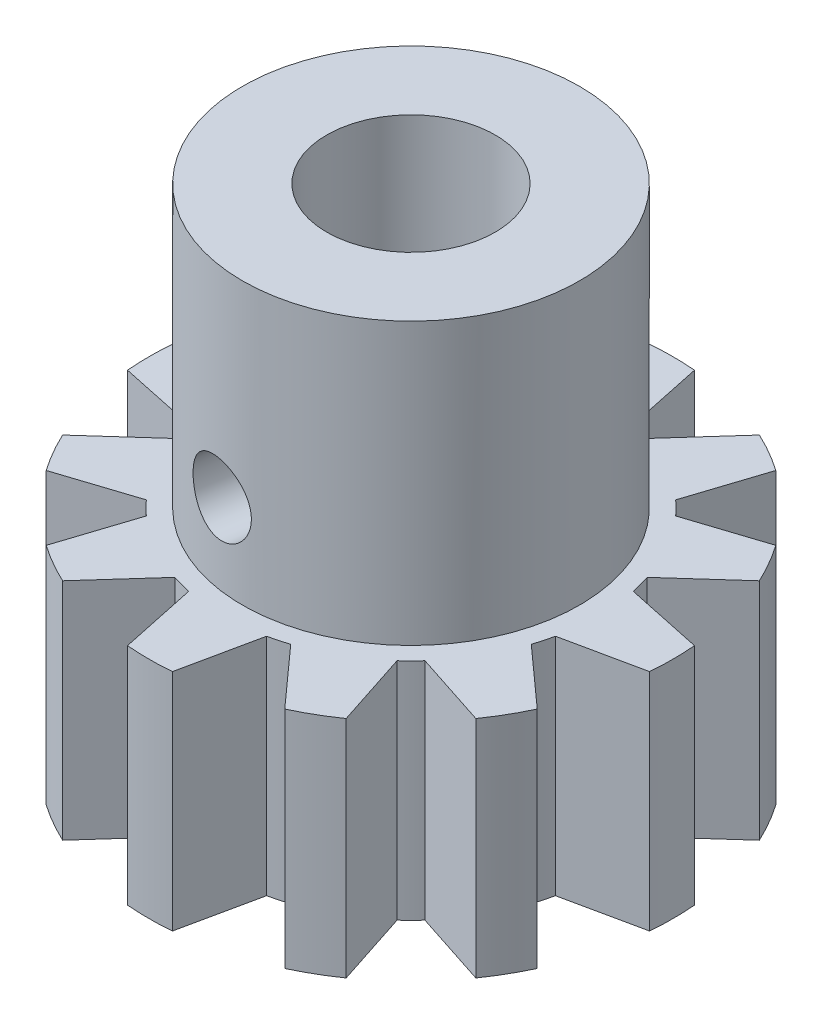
SolidWorks part; units mm, degrees
ref_plane "Front Plane" through (0, 0, 0) normal (0, 0, 1) x (1, 0, 0)
ref_plane "Top Plane" through (0, 0, 0) normal (0, 1, 0) x (1, 0, 0)
ref_plane "Right Plane" through (0, 0, 0) normal (1, 0, 0) x (0, 0, -1)
sketch "Sketch1" plane through (0, 0, 0) normal (0, 1, 0) x (1, 0, 0)
  line L0 (-0.635, 7.3768) -> (-1.0998, 5.1804)
  line L1 (0.635, 7.3768) -> (1.0998, 5.1804)
  line L2 (4.2383, 6.071) -> (3.5427, 3.9365)
  line L3 (3.1385, 6.706) -> (1.6378, 5.0363)
  line L4 (6.706, 3.1385) -> (5.0363, 1.6378)
  line L5 (6.071, 4.2383) -> (3.9365, 3.5427)
  line L6 (7.3768, -0.635) -> (5.1804, -1.0998)
  line L7 (7.3768, 0.635) -> (5.1804, 1.0998)
  line L8 (6.071, -4.2383) -> (3.9365, -3.5427)
  line L9 (6.706, -3.1385) -> (5.0363, -1.6378)
  line L10 (3.1385, -6.706) -> (1.6378, -5.0363)
  line L11 (4.2383, -6.071) -> (3.5427, -3.9365)
  line L12 (-0.635, -7.3768) -> (-1.0998, -5.1804)
  line L13 (0.635, -7.3768) -> (1.0998, -5.1804)
  line L14 (-4.2383, -6.071) -> (-3.5427, -3.9365)
  line L15 (-3.1385, -6.706) -> (-1.6378, -5.0363)
  line L16 (-6.706, -3.1385) -> (-5.0363, -1.6378)
  line L17 (-6.071, -4.2383) -> (-3.9365, -3.5427)
  line L18 (-7.3768, 0.635) -> (-5.1804, 1.0998)
  line L19 (-7.3768, -0.635) -> (-5.1804, -1.0998)
  line L20 (-6.071, 4.2383) -> (-3.9365, 3.5427)
  line L21 (-6.706, 3.1385) -> (-5.0363, 1.6378)
  line L22 (-3.1385, 6.706) -> (-1.6378, 5.0363)
  line L23 (-4.2383, 6.071) -> (-3.5427, 3.9365)
  circle A0 centre (0, 0) radius 5.2959 construction
  circle A1 centre (0, 0) radius 2.3813
  circle A2 centre (0, 0) radius 7.4041 construction
  circle A3 centre (0, 0) radius 6.35 construction
  arc A4 (-0.635, 7.3768) -> (0.635, 7.3768) centre (0, 0) cw
  arc A5 (1.0998, 5.1804) -> (1.6378, 5.0363) centre (0, 0) cw
  arc A6 (3.5427, 3.9365) -> (3.9365, 3.5427) centre (0, 0) cw
  arc A7 (3.1385, 6.706) -> (4.2383, 6.071) centre (0, 0) cw
  arc A8 (5.0363, 1.6378) -> (5.1804, 1.0998) centre (0, 0) cw
  arc A9 (6.071, 4.2383) -> (6.706, 3.1385) centre (0, 0) cw
  arc A10 (5.1804, -1.0998) -> (5.0363, -1.6378) centre (0, 0) cw
  arc A11 (7.3768, 0.635) -> (7.3768, -0.635) centre (0, 0) cw
  arc A12 (3.9365, -3.5427) -> (3.5427, -3.9365) centre (0, 0) cw
  arc A13 (6.706, -3.1385) -> (6.071, -4.2383) centre (0, 0) cw
  arc A14 (1.6378, -5.0363) -> (1.0998, -5.1804) centre (0, 0) cw
  arc A15 (4.2383, -6.071) -> (3.1385, -6.706) centre (0, 0) cw
  arc A16 (-1.0998, -5.1804) -> (-1.6378, -5.0363) centre (0, 0) cw
  arc A17 (0.635, -7.3768) -> (-0.635, -7.3768) centre (0, 0) cw
  arc A18 (-3.5427, -3.9365) -> (-3.9365, -3.5427) centre (0, 0) cw
  arc A19 (-3.1385, -6.706) -> (-4.2383, -6.071) centre (0, 0) cw
  arc A20 (-5.0363, -1.6378) -> (-5.1804, -1.0998) centre (0, 0) cw
  arc A21 (-6.071, -4.2383) -> (-6.706, -3.1385) centre (0, 0) cw
  arc A22 (-5.1804, 1.0998) -> (-5.0363, 1.6378) centre (0, 0) cw
  arc A23 (-7.3768, -0.635) -> (-7.3768, 0.635) centre (0, 0) cw
  arc A24 (-3.9365, 3.5427) -> (-3.5427, 3.9365) centre (0, 0) cw
  arc A25 (-6.706, 3.1385) -> (-6.071, 4.2383) centre (0, 0) cw
  arc A26 (-1.6378, 5.0363) -> (-1.0998, 5.1804) centre (0, 0) cw
  arc A27 (-4.2383, 6.071) -> (-3.1385, 6.706) centre (0, 0) cw
  point P6 (0, 7.4041)
  point P130 (0, 0)
  dimension "D1" = 12.7
  dimension "D2" = 14.8082
  dimension "D3" = 10.5918
  dimension "D4" = 4.7625
  dimension "D5" = 1.27
  dimension "D6" = 12
extrude "Boss-Extrude1" add sketch "Sketch1" along normal blind 6.35
sketch "Sketch2" plane through (0, 6.35, 0) normal (0, 1, 0) x (1, 0, 0)
  circle A0 centre (0, 0) radius 2.3813
  circle A1 centre (0, 0) radius 4.7625
  circle A2 centre (0, 0) radius 2.3813 construction
  dimension "D1" = 9.525
extrude "Boss-Extrude2" add sketch "Sketch2" along normal blind 7.9375
sketch "Sketch3" plane through (-15.449, 0, -3.9886) normal (-0.1578, 0, 0.9875) x (0.9875, 0, 0.1578)
  spline S1 degree 3 poles (16.0176, 9.5647) (15.7522, 9.5647) (15.6221, 9.538) (15.3824, 9.4378) (15.2734, 9.3643) (15.0926, 9.1834) (15.0192, 9.0742) (14.9197, 8.8363) (14.8929, 8.7049) (14.8925, 8.4427) (14.9187, 8.3117) (15.0193, 8.0702) (15.0923, 7.962) (15.2735, 7.7806) (15.3827, 7.7071) (15.621, 7.6074) (15.7529, 7.5805) (16.0143, 7.5801) (16.146, 7.6065) (16.3864, 7.7066) (16.4951, 7.7795) (16.6777, 7.9622) (16.7504, 8.0704) (16.8503, 8.3095) (16.8769, 8.4408) (16.8772, 8.7025) (16.8506, 8.8343) (16.751, 9.0734) (16.6781, 9.1823) (16.496, 9.3647) (16.3886, 9.4373) (16.1466, 9.5385) (16.0176, 9.5647) (15.7522, 9.5647) (15.6221, 9.538) knots -0.0625 -0.0625 0 0 0.0625 0.0625 0.125 0.125 0.1875 0.1875 0.25 0.25 0.3125 0.3125 0.375 0.375 0.4375 0.4375 0.5 0.5 0.5625 0.5625 0.625 0.625 0.6875 0.6875 0.75 0.75 0.8125 0.8125 0.875 0.875 0.9375 0.9375 1 1 1.0625 1.0625 1.125 only from (15.8849, 9.5647) to (15.8849, 9.5647) construction
  spline S2 degree 3 poles (16.0176, 9.5647) (15.7522, 9.5647) (15.6221, 9.538) (15.3824, 9.4378) (15.2734, 9.3643) (15.0926, 9.1834) (15.0192, 9.0742) (14.9197, 8.8363) (14.8929, 8.7049) (14.8925, 8.4427) (14.9187, 8.3117) (15.0193, 8.0702) (15.0923, 7.962) (15.2735, 7.7806) (15.3827, 7.7071) (15.621, 7.6074) (15.7529, 7.5805) (16.0143, 7.5801) (16.146, 7.6065) (16.3864, 7.7066) (16.4951, 7.7795) (16.6777, 7.9622) (16.7504, 8.0704) (16.8503, 8.3095) (16.8769, 8.4408) (16.8772, 8.7025) (16.8506, 8.8343) (16.751, 9.0734) (16.6781, 9.1823) (16.496, 9.3647) (16.3886, 9.4373) (16.1466, 9.5385) (16.0176, 9.5647) (15.7522, 9.5647) (15.6221, 9.538) knots -0.0625 -0.0625 0 0 0.0625 0.0625 0.125 0.125 0.1875 0.1875 0.25 0.25 0.3125 0.3125 0.375 0.375 0.4375 0.4375 0.5 0.5 0.5625 0.5625 0.625 0.625 0.6875 0.6875 0.75 0.75 0.8125 0.8125 0.875 0.875 0.9375 0.9375 1 1 1.0625 1.0625 1.125 only from (15.8849, 9.5647) to (15.8849, 9.5647)
extrude "Cut-Extrude1" cut sketch "Sketch3" against normal through all both and the other way through all
